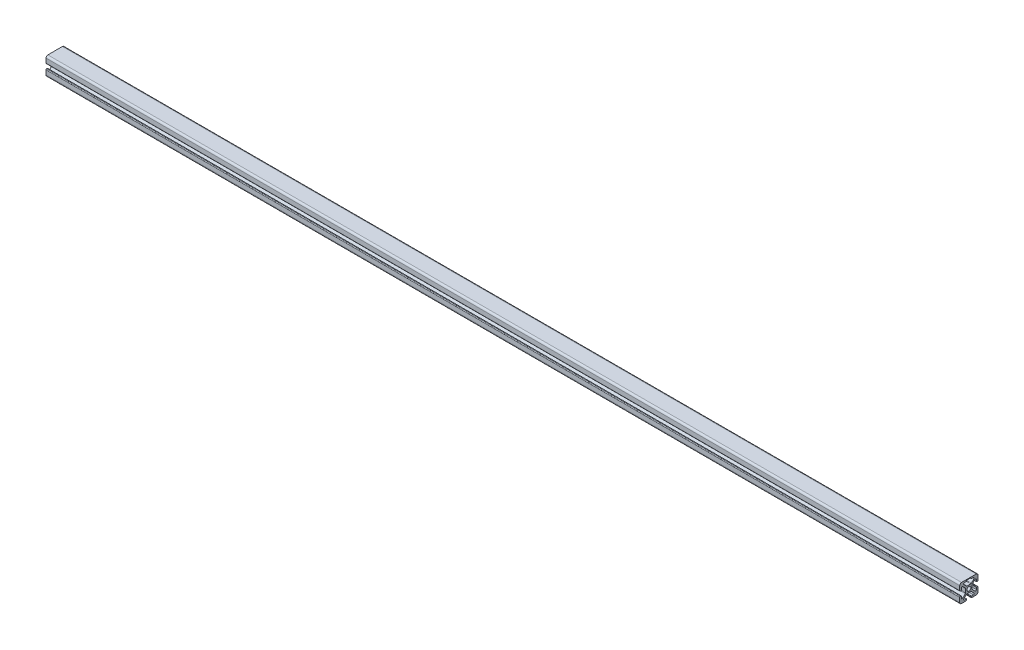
SolidWorks part; units mm, degrees
ref_plane "Ebene vorne" through (0, 0, 0) normal (0, 0, 1) x (1, 0, 0)
ref_plane "Ebene oben" through (0, 0, 0) normal (0, 1, 0) x (1, 0, 0)
ref_plane "Ebene rechts" through (0, 0, 0) normal (1, 0, 0) x (0, 0, -1)
sketch "Skizze1" plane through (0, 0, 0) normal (0, 1, 0) x (1, 0, 0)
  line L0 (0, 0) -> (1000, 0)
  dimension "D1" = 1000
other "Strukturbauteil1"
ref_plane "Ebene1" through (0, 0, 0) normal (1, 0, 0) x (0, 0, -1)
sketch "Model" plane through (0, 0, 0) normal (1, 0, 0) x (0, 0, -1)
  line L0 (-8.5, -2.5) -> (-9.3, -2.5)
  line L1 (-10, -3.2) -> (-10, -8)
  line L2 (-8, -10) -> (-3.2, -10)
  line L3 (-2.5, -9.3) -> (-2.5, -8.5)
  line L4 (-2.8, -8.2) -> (-4.8676, -8.2)
  line L5 (-5.4915, -6.6936) -> (-2.7408, -3.9429)
  line L6 (-2.0337, -3.65) -> (2.0337, -3.65)
  line L7 (4.8676, -8.2) -> (2.8, -8.2)
  line L8 (2.7408, -3.9429) -> (5.4915, -6.6936)
  line L9 (2.5, -8.5) -> (2.5, -9.3)
  line L10 (3.2, -10) -> (8, -10)
  line L12 (3.9429, -2.7408) -> (6.6936, -5.4915)
  line L13 (8.2, -4.8676) -> (8.2, -2.8)
  line L14 (8.5, -2.5) -> (9.3, -2.5)
  line L15 (10, -3.2) -> (10, -8)
  line L16 (10, 8) -> (10, 3.2)
  line L17 (9.3, 2.5) -> (8.5, 2.5)
  line L18 (8.2, 2.8) -> (8.2, 4.8676)
  line L19 (6.6936, 5.4915) -> (3.9429, 2.7408)
  line L20 (2.5, 9) -> (2.5, 8.5)
  line L21 (2.8, 8.2) -> (4.8676, 8.2)
  line L22 (5.4915, 6.6936) -> (2.7408, 3.9429)
  line L23 (2.0337, 3.65) -> (-2.0337, 3.65)
  line L24 (-2.7408, 3.9429) -> (-5.4915, 6.6936)
  line L25 (-4.8676, 8.2) -> (-2.8, 8.2)
  line L26 (8, 10) -> (-8, 10)
  line L27 (2.2, 9.3) -> (-2.2, 9.3)
  line L28 (-2.5, 8.5) -> (-2.5, 9)
  line L29 (-10, 8) -> (-10, 3.2)
  line L30 (-9.3, 2.5) -> (-8.5, 2.5)
  line L31 (-8.2, 2.8) -> (-8.2, 4.8676)
  line L32 (-3.65, 2.0337) -> (-3.65, -2.0337)
  line L33 (-6.6936, 5.4915) -> (-3.9429, 2.7408)
  line L34 (-8.2, -4.8676) -> (-8.2, -2.8)
  line L35 (-3.9429, -2.7408) -> (-6.6936, -5.4915)
  line L36 (3.65, 2.0337) -> (3.65, -2.0337)
  line L37 (-10, 10) -> (10, 10) construction
  line L38 (-10, 10) -> (-10, -10) construction
  line L39 (-10, -10) -> (10, -10) construction
  line L40 (10, 10) -> (10, -10) construction
  line L41 (-10, 10) -> (10, -10) construction
  line L42 (-10, -10) -> (10, 10) construction
  circle A0 centre (0, 0) radius 2.15
  arc A1 (-8.2, -2.8) -> (-8.5, -2.5) centre (-8.5, -2.8) ccw
  arc A2 (-9.3, -2.5) -> (-10, -3.2) centre (-9.3, -3.2) ccw
  arc A3 (-10, -8) -> (-8, -10) centre (-8, -8) ccw
  arc A4 (-3.2, -10) -> (-2.5, -9.3) centre (-3.2, -9.3) ccw
  arc A5 (-2.5, -8.5) -> (-2.8, -8.2) centre (-2.8, -8.5) ccw
  arc A6 (-5.4915, -6.6936) -> (-4.8676, -8.2) centre (-4.8676, -7.3176) ccw
  arc A7 (-2.0337, -3.65) -> (-2.7408, -3.9429) centre (-2.0337, -4.65) ccw
  arc A8 (2.7408, -3.9429) -> (2.0337, -3.65) centre (2.0337, -4.65) ccw
  arc A9 (4.8676, -8.2) -> (5.4915, -6.6936) centre (4.8676, -7.3176) ccw
  arc A10 (2.8, -8.2) -> (2.5, -8.5) centre (2.8, -8.5) ccw
  arc A11 (2.5, -9.3) -> (3.2, -10) centre (3.2, -9.3) ccw
  arc A12 (8, -10) -> (10, -8) centre (8, -8) ccw
  arc A13 (3.9429, -2.7408) -> (3.65, -2.0337) centre (4.65, -2.0337) cw
  arc A14 (8.2, -4.8676) -> (6.6936, -5.4915) centre (7.3176, -4.8676) cw
  arc A15 (8.2, -2.8) -> (8.5, -2.5) centre (8.5, -2.8) cw
  arc A16 (9.3, -2.5) -> (10, -3.2) centre (9.3, -3.2) cw
  arc A17 (10, 3.2) -> (9.3, 2.5) centre (9.3, 3.2) cw
  arc A18 (8.5, 2.5) -> (8.2, 2.8) centre (8.5, 2.8) cw
  arc A19 (6.6936, 5.4915) -> (8.2, 4.8676) centre (7.3176, 4.8676) cw
  arc A20 (3.65, 2.0337) -> (3.9429, 2.7408) centre (4.65, 2.0337) cw
  arc A21 (10, 8) -> (8, 10) centre (8, 8) ccw
  arc A22 (2.5, 8.5) -> (2.8, 8.2) centre (2.8, 8.5) ccw
  arc A23 (5.4915, 6.6936) -> (4.8676, 8.2) centre (4.8676, 7.3176) ccw
  arc A24 (2.0337, 3.65) -> (2.7408, 3.9429) centre (2.0337, 4.65) ccw
  arc A25 (-2.7408, 3.9429) -> (-2.0337, 3.65) centre (-2.0337, 4.65) ccw
  arc A26 (-4.8676, 8.2) -> (-5.4915, 6.6936) centre (-4.8676, 7.3176) ccw
  arc A27 (2.5, 9) -> (2.2, 9.3) centre (2.2, 9) ccw
  arc A28 (-2.2, 9.3) -> (-2.5, 9) centre (-2.2, 9) ccw
  arc A29 (-2.8, 8.2) -> (-2.5, 8.5) centre (-2.8, 8.5) ccw
  arc A30 (-8, 10) -> (-10, 8) centre (-8, 8) ccw
  arc A31 (-10, 3.2) -> (-9.3, 2.5) centre (-9.3, 3.2) ccw
  arc A32 (-8.5, 2.5) -> (-8.2, 2.8) centre (-8.5, 2.8) ccw
  arc A33 (-6.6936, 5.4915) -> (-8.2, 4.8676) centre (-7.3176, 4.8676) ccw
  arc A34 (-3.65, 2.0337) -> (-3.9429, 2.7408) centre (-4.65, 2.0337) ccw
  arc A35 (-3.9429, -2.7408) -> (-3.65, -2.0337) centre (-4.65, -2.0337) ccw
  arc A36 (-8.2, -4.8676) -> (-6.6936, -5.4915) centre (-7.3176, -4.8676) ccw
  point P38 (0, 0)
  point P114 (0, 10)
  point P115 (-10, 0)
  point P116 (0, -10)
  point P117 (10, 0)
